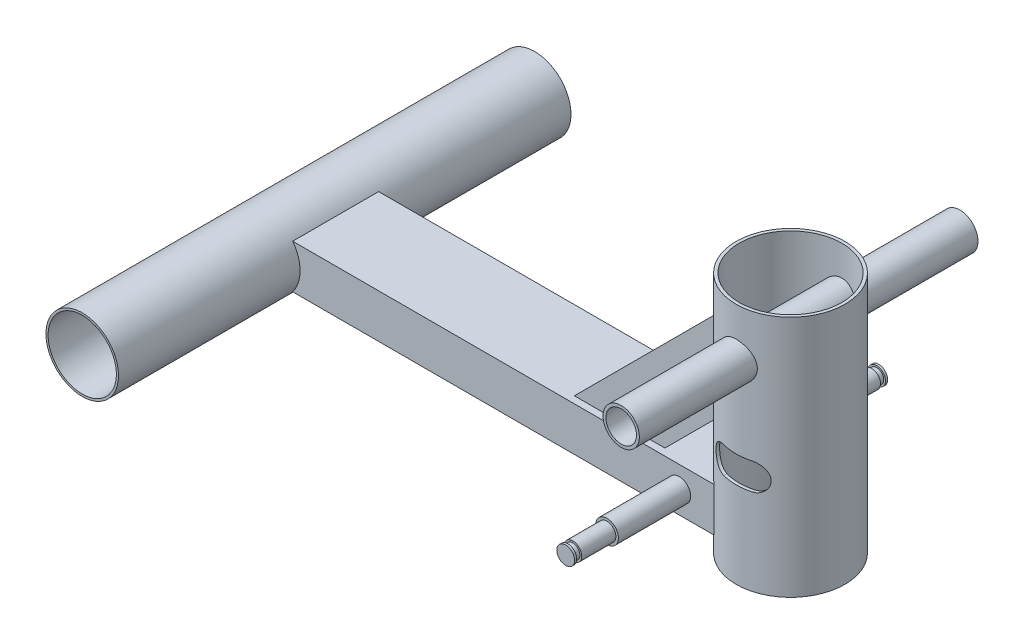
SolidWorks part; units mm, degrees
ref_plane "Plan1" through (0, 0, 0) normal (0, 0, 1) x (1, 0, 0)
ref_plane "Plan2" through (0, 0, 0) normal (0, 1, 0) x (1, 0, 0)
ref_plane "Plan3" through (0, 0, 0) normal (1, 0, 0) x (0, 0, -1)
sketch "Esquisse1" plane through (0, 0, 0) normal (0, 0, 1) x (1, 0, 0)
  circle A0 centre (0, 0) radius 25.5
  circle A1 centre (0, 0) radius 24
  dimension "D1" = 51
  dimension "D2" = 48
extrude "Base-Extrusion" add sketch "Esquisse1" along normal blind 318
ref_plane "Plan4" through (303, 0, 0) normal (1, 0, 0) x (0, 0, -1)
sketch "Esquisse3" plane through (303, 0, 0) normal (1, 0, 0) x (0, 0, -1)
  line L0 (-190.4, 15.4) -> (-190.4, -15.4)
  line L1 (-190.4, -15.4) -> (-130, -15.4)
  line L2 (-130, -15.4) -> (-130, 15.4)
  line L3 (-130, 15.4) -> (-190.4, 15.4)
  line L4 (0, 50) -> (0, -50) construction
  line L5 (0, 25.5) -> (-318, 25.5) construction
  line L7 (-131, 14.4) -> (-189.4, 14.4)
  line L8 (-131, -14.4) -> (-131, 14.4)
  line L9 (-189.4, -14.4) -> (-131, -14.4)
  line L10 (-189.4, 14.4) -> (-189.4, -14.4)
  dimension "D1" = 60.4
  dimension "D2" = 30.8
  dimension "D3" = 130
  dimension "D4" = 10.1
  dimension "D5" = 1
extrude "Boss.-Extru.3" add sketch "Esquisse3" along normal up to surface (282.6754 mm away)
ref_plane "Plan6" through (223, 0, 0) normal (1, 0, 0) x (0, 0, -1)
ref_plane "Plan7" through (0, -29.6, 0) normal (0, 1, 0) x (-1, 0, 0)
sketch "Esquisse8" plane through (0, -29.6, 0) normal (0, 1, 0) x (-1, 0, 0)
  line L1 (-303, 130) -> (-303, 190.4) construction
  circle A0 centre (-340, 160.2) radius 38.25
  circle A1 centre (-340, 160.2) radius 36.1
  dimension "D3" = 76.5
  dimension "D4" = 72.2
  dimension "D1" = 30.2
  dimension "D2" = 37
extrude "Boss.-Extru.6" add sketch "Esquisse8" along normal blind 170.5
sketch "Esquisse10" plane through (223, 0, 0) normal (1, 0, 0) x (0, 0, -1)
  line L0 (-190.4, 15.4) -> (-190.4, -15.4)
  line L1 (-190.4, -15.4) -> (-130, -15.4)
  line L2 (-130, -15.4) -> (-130, 15.4)
  line L3 (-130, 15.4) -> (-190.4, 15.4)
  line L4 (-190.4, 15.4) -> (-190.4, -15.4) construction
  line L5 (-169.8986, 15.4) -> (-190.4, 15.4) construction
  line L6 (-190.4, -15.4) -> (-169.8986, -15.4) construction
  line L7 (-130, -15.4) -> (-130, 15.4) construction
  line L8 (-189.4, -14.4) -> (-131, -14.4)
  line L9 (-189.4, 14.4) -> (-189.4, -14.4)
  line L10 (-131, 14.4) -> (-189.4, 14.4)
  line L11 (-131, -14.4) -> (-131, 14.4)
  dimension "D1" = 1
extrude "Boss.-Extru.7" add sketch "Esquisse10" along normal up to surface (93.5261 mm away)
sketch "Esquisse11" plane through (0, 0, 0) normal (0, 0, 1) x (1, 0, 0)
  line L0 (330, 49.8) -> (350, 49.8)
  line L1 (330, 31) -> (350, 31)
  line L4 (301.75, 140.9) -> (301.75, 15.4) construction
  line L7 (301.75, -29.6) -> (378.25, -29.6) construction
  arc A0 (330, 49.8) -> (330, 31) centre (330, 40.4) ccw
  arc A1 (350, 49.8) -> (350, 31) centre (350, 40.4) cw
  dimension "D1" = 18.8
  dimension "D2" = 20
  dimension "D3" = 28.25
  dimension "D4" = 70
extrude "Enlèv. mat.-Extru.2" cut sketch "Esquisse11" along normal through all
ref_plane "Plan8" through (0, 0, 160.2) normal (0, 0, 1) x (1, 0, 0)
ref_plane "Plan9" through (0, 0, 190.4) normal (0, 0, 1) x (1, 0, 0)
sketch "Esquisse17" plane through (0, 0, 160.2) normal (0, 0, 1) x (1, 0, 0)
  line L0 (340, 49.8) -> (340, 31) construction
  line L1 (378.25, 140.9) -> (301.75, 140.9) construction
  circle A0 centre (340, 106.9) radius 12.75
  dimension "D2" = 25.5
  dimension "D1" = 34
extrude "Boss.-Extru.9" add sketch "Esquisse17" along normal mid plane 238
sketch "Esquisse18" plane through (0, 0, 160.2) normal (0, 0, 1) x (1, 0, 0)
  line L0 (50, 0) -> (-50, 0) construction
  line L1 (292, -108) -> (292, 216) construction
  circle A0 centre (292, 0) radius 8
  dimension "D1" = 16
extrude "Boss.-Extru.10" add sketch "Esquisse18" along normal mid plane 162
sketch "Esquisse19" plane through (0, 0, 241.2) normal (0, 0, 1) x (1, 0, 0)
  circle A0 centre (292, 0) radius 6.25
  dimension "D1" = 12.5
extrude "Boss.-Extru.11" add sketch "Esquisse19" along normal blind 24
sketch "Esquisse20" plane through (0, 0, 265.2) normal (0, 0, 1) x (1, 0, 0)
  circle A0 centre (292, 0) radius 5
  dimension "D1" = 10
extrude "Boss.-Extru.12" add sketch "Esquisse20" along normal blind 3.5
sketch "Esquisse21" plane through (0, 0, 268.7) normal (0, 0, 1) x (1, 0, 0)
  circle A0 centre (292, 0) radius 6.25
  dimension "D1" = 12.5
extrude "Boss.-Extru.13" add sketch "Esquisse21" along normal blind 1.5
sketch "Esquisse22" plane through (0, 0, 79.2) normal (0, 0, -1) x (-1, 0, 0)
  circle A0 centre (-292, 0) radius 6.25
  circle A1 centre (-292, 0) radius 6.25 construction
extrude "Boss.-Extru.14" add sketch "Esquisse22" along normal blind 24
sketch "Esquisse23" plane through (0, 0, 55.2) normal (0, 0, -1) x (-1, 0, 0)
  circle A0 centre (-292, 0) radius 5
  circle A1 centre (-292, 0) radius 5 construction
extrude "Boss.-Extru.15" add sketch "Esquisse23" along normal blind 3.5
sketch "Esquisse24" plane through (0, 0, 51.7) normal (0, 0, -1) x (-1, 0, 0)
  circle A0 centre (-292, 0) radius 6.25
  circle A2 centre (-292, 0) radius 6.25 construction
extrude "Boss.-Extru.16" add sketch "Esquisse24" along normal blind 1.5
ref_plane "Plan12" through (17.8623, 17.8623, 0) normal (0.7071, 0.7071, 0) x (0, 0, -1)
ref_plane "Plan13" through (159.2837, 159.2837, 0) normal (0.7071, 0.7071, 0) x (0, 0, -1)
sketch "Esquisse25" plane through (159.2837, 159.2837, 0) normal (0.7071, 0.7071, 0) x (0, 0, -1)
  line L0 (-185.5, -185) -> (-185.5, -140)
  line L1 (-185.5, -140) -> (-135, -140)
  line L2 (-135, -140) -> (-135, -185)
  line L3 (-136, -141) -> (-136, -185)
  line L4 (-184.5, -141) -> (-136, -141)
  line L5 (-184.5, -185) -> (-184.5, -141)
  line L6 (-184.5, -185) -> (-185.5, -185)
  line L7 (-135, -185) -> (-136, -185)
  dimension "D1" = 1
extrude "Boss.-Extru.19" add sketch "Esquisse25" along normal up to surface (18.4822 mm away)
sketch "Esquisse26" plane through (159.2837, 159.2837, 0) normal (0.7071, 0.7071, 0) x (0, 0, -1)
  line L0 (-185.5, -185) -> (-185.5, -140)
  line L1 (-185.5, -140) -> (-135, -140)
  line L2 (-135, -140) -> (-135, -185)
  line L3 (-185.5, -185) -> (-184.5, -185)
  line L4 (-135, -185) -> (-136, -185)
  line L5 (-184.5, -185) -> (-184.5, -141)
  line L6 (-184.5, -141) -> (-136, -141)
  line L7 (-136, -141) -> (-136, -185)
extrude "Boss.-Extru.20" add sketch "Esquisse26" along normal up to surface (75.0012 mm away)
sketch "Esquisse27" plane through (0, 0, 41.2) normal (0, 0, -1) x (-1, 0, 0)
  circle A0 centre (-340, 106.9) radius 10.75
  dimension "D1" = 21.5
extrude "Enlèv. mat.-Extru.3" cut sketch "Esquisse27" against normal through all
